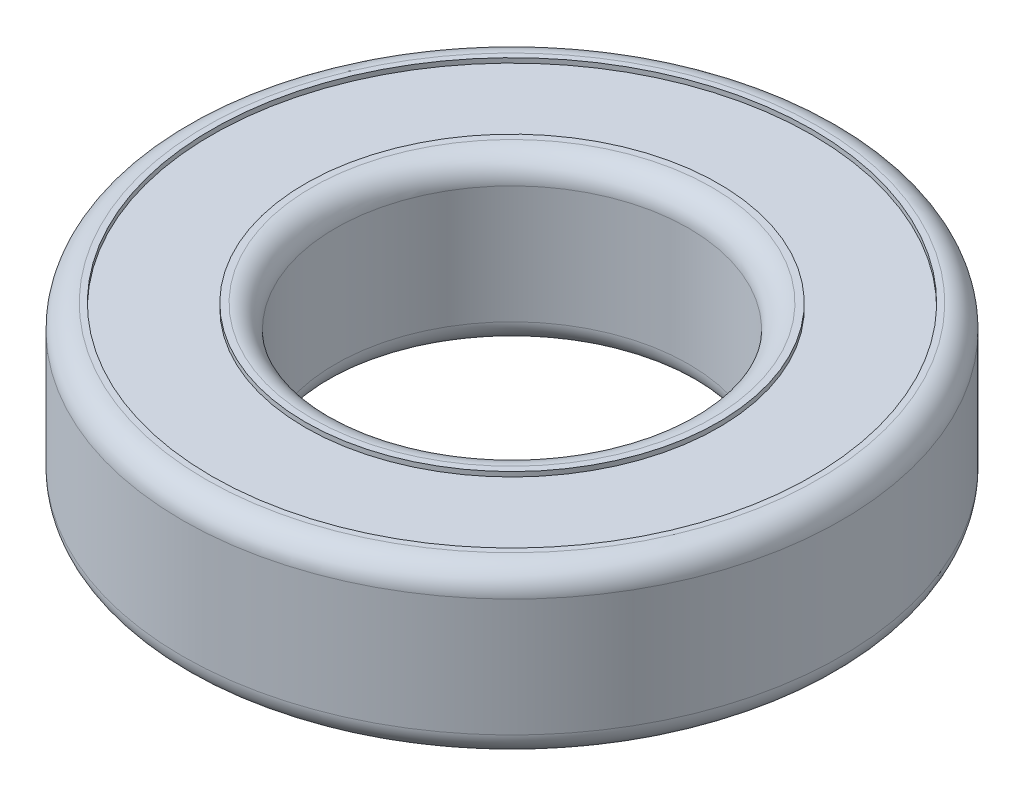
SolidWorks part; units mm, degrees
ref_plane "Спереди" through (0, 0, 0) normal (0, 0, 1) x (1, 0, 0)
ref_plane "Сверху" through (0, 0, 0) normal (0, 1, 0) x (1, 0, 0)
ref_plane "Справа" through (0, 0, 0) normal (1, 0, 0) x (0, 0, -1)
sketch "Эскиз1" plane through (0, 0, 0) normal (0, 0, 1) x (1, 0, 0)
  line L0 (0, 0) -> (0, 14.6009) construction
  line L2 (-13, 3.5) -> (-8.5, 3.5)
  line L3 (-14, 2.5) -> (-14, -2.5)
  line L4 (-13, -3.5) -> (-8.5, -3.5)
  line L5 (-7.5, 2.5) -> (-7.5, -2.5)
  line L6 (-14, 3.5) -> (-7.5, -3.5) construction
  line L7 (-14, -3.5) -> (-7.5, 3.5) construction
  arc A0 (-8.5, -3.5) -> (-7.5, -2.5) centre (-8.5, -2.5) ccw
  arc A1 (-14, -2.5) -> (-13, -3.5) centre (-13, -2.5) ccw
  arc A2 (-13, 3.5) -> (-14, 2.5) centre (-13, 2.5) ccw
  arc A3 (-8.5, 3.5) -> (-7.5, 2.5) centre (-8.5, 2.5) cw
  point P3 (-10.75, 0)
  dimension "D4" = 1
  dimension "D1" = 15
  dimension "D2" = 28
  dimension "D3" = 7
revolve "Повернуть1" add sketch "Эскиз1" angle 360 about L0
sketch "Эскиз2" plane through (0, 3.5, 0) normal (0, 1, 0) x (1, 0, 0)
  circle A0 centre (0, 0) radius 8.7781
  circle A1 centre (0, 0) radius 12.7564
extrude "Вырез-Вытянуть1" cut sketch "Эскиз2" against normal blind 0.2
mirror "Зеркальное отражение1" about plane through (0, 0, 0) normal (0, 1, 0) of "Вырез-Вытянуть1"
